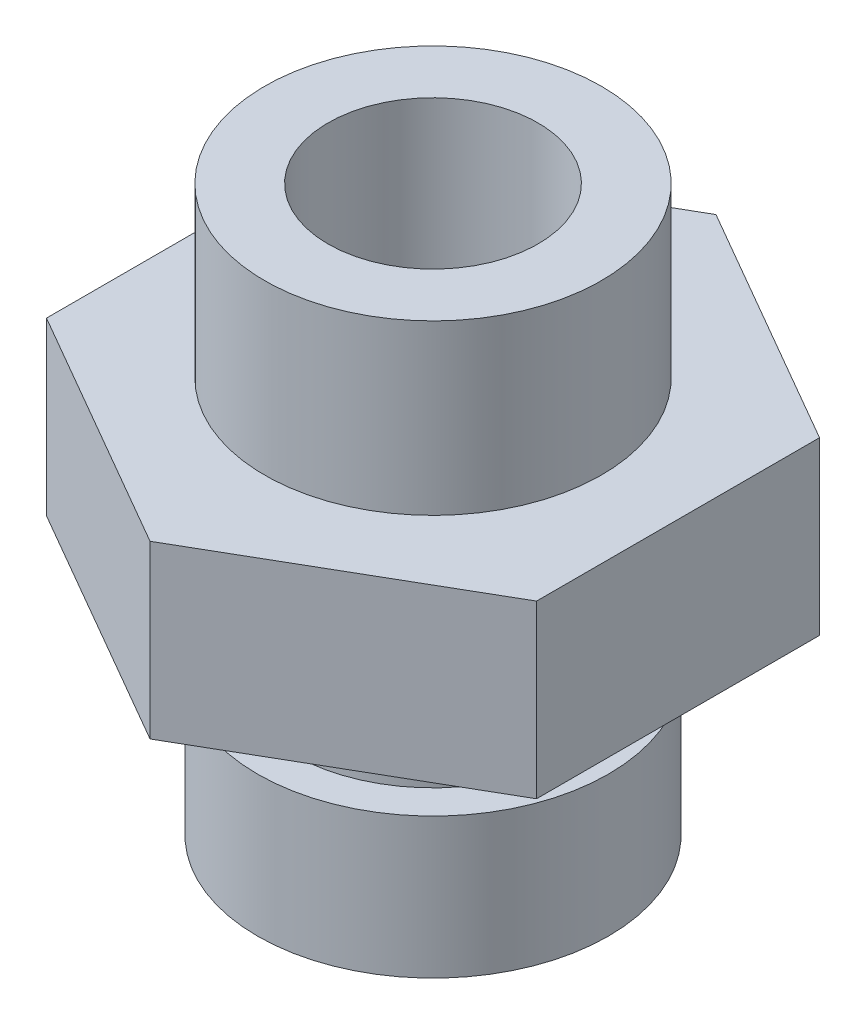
SolidWorks part; units mm, degrees
ref_plane "Front Plane" through (0, 0, 0) normal (0, 0, 1) x (1, 0, 0)
ref_plane "Top Plane" through (0, 0, 0) normal (0, 1, 0) x (1, 0, 0)
ref_plane "Right Plane" through (0, 0, 0) normal (1, 0, 0) x (0, 0, -1)
sketch "Sketch1" plane through (0, 0, 0) normal (0, 1, 0) x (1, 0, 0)
  line L0 (-5.5435, 0) -> (5.5435, 0) construction
  line L1 (-2.7718, -4.8009) -> (-5.5436, -3.2006)
  line L2 (-2.7718, -4.8009) -> (0, -6.4011)
  line L3 (2.7718, -4.8009) -> (0, -6.4011)
  line L4 (5.5435, -3.2006) -> (5.5435, 3.2006)
  line L5 (2.7718, 4.8009) -> (5.5435, 3.2006)
  line L6 (2.7718, 4.8009) -> (0, 6.4011)
  line L7 (-2.7718, 4.8009) -> (0, 6.4011)
  line L8 (-2.7718, 4.8009) -> (-5.5436, 3.2006)
  line L9 (-5.5436, -3.2006) -> (-5.5436, 3.2006)
  line L10 (2.7718, -4.8009) -> (5.5435, -3.2006)
  dimension "D1" = 11.0871
  dimension "D2" = 11.0871
extrude "Extrude1" add sketch "Sketch1" along normal blind 3.8735
sketch "Sketch2" plane through (0, 0, 0) normal (0, -1, 0) x (1, 0, 0)
  circle A0 centre (0, 0) radius 3.1877
extrude "Extrude2" add sketch "Sketch2" along normal blind 1.905
sketch "Sketch3" plane through (0, -1.905, 0) normal (0, -1, 0) x (1, 0, 0)
  circle A0 centre (0, 0) radius 3.9688
extrude "Extrude3" add sketch "Sketch3" along normal blind 3.175
sketch "Sketch4" plane through (0, 3.8735, 0) normal (0, 1, 0) x (-1, 0, 0)
  circle A0 centre (0, 0) radius 3.81
extrude "Extrude4" add sketch "Sketch4" along normal blind 3.81
sketch "Sketch5" plane through (0, 7.6835, 0) normal (0, 1, 0) x (-1, 0, 0)
  circle A0 centre (0, 0) radius 1.7272
extrude "Cut-Extrude1" cut sketch "Sketch5" against normal through all
sketch "Sketch6" plane through (0, 7.6835, 0) normal (0, 1, 0) x (-1, 0, 0)
  circle A0 centre (0, 0) radius 2.3749
extrude "Cut-Extrude2" cut sketch "Sketch6" against normal blind 5.08
